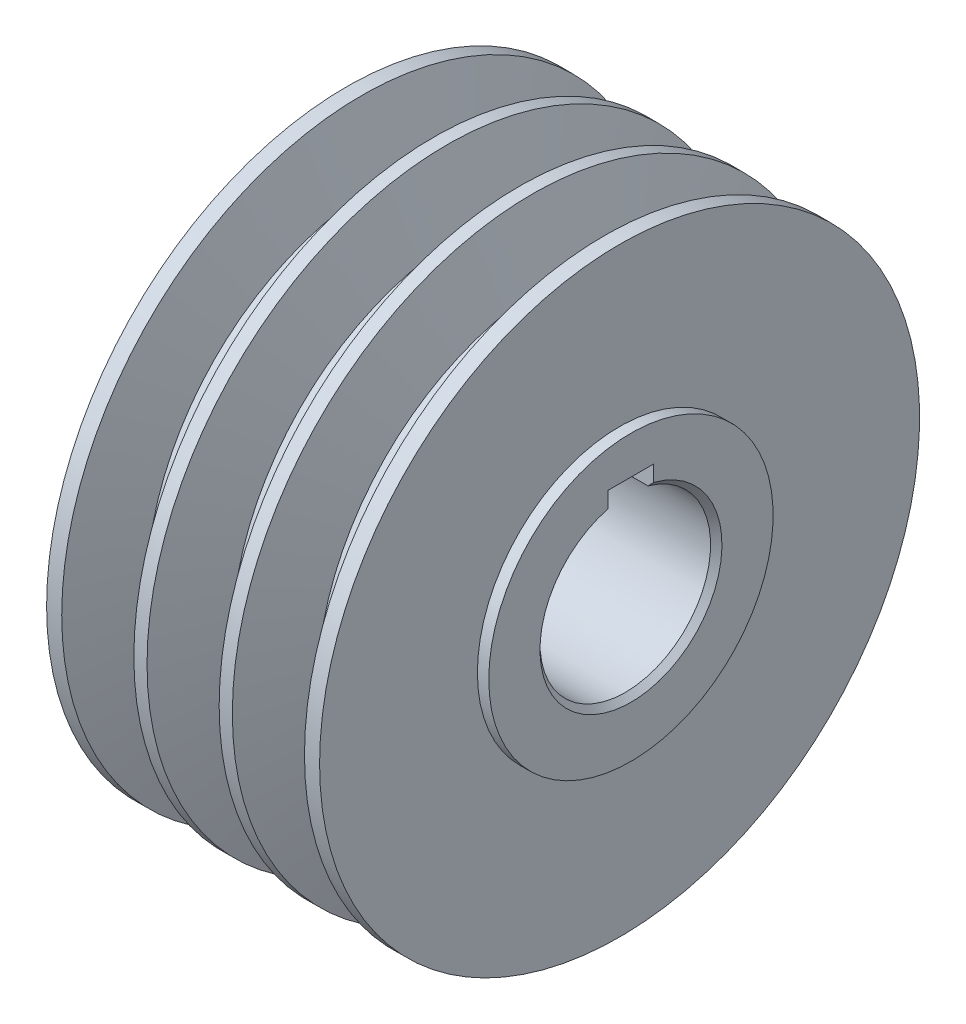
SolidWorks part; units mm, degrees
ref_plane "前视基准面" through (0, 0, 0) normal (0, 0, 1) x (1, 0, 0)
ref_plane "上视基准面" through (0, 0, 0) normal (0, 1, 0) x (1, 0, 0)
ref_plane "右视基准面" through (0, 0, 0) normal (1, 0, 0) x (0, 0, -1)
sketch "草图1" plane through (0, 0, 0) normal (0, 0, 1) x (1, 0, 0)
  line L0 (0, 0) -> (64.8368, 0) construction
  line L1 (0, 15) -> (0, 52.75)
  line L2 (0, 52.75) -> (48, 52.75)
  line L3 (48, 52.75) -> (48, 25)
  line L4 (48, 25) -> (50, 25)
  line L5 (50, 25) -> (50, 15)
  line L6 (50, 15) -> (0, 15)
  line L7 (2.6592, 52.75) -> (6.1599, 41.3) construction
  line L8 (6.1599, 41.3) -> (11.8401, 41.3) construction
  line L9 (11.8401, 41.3) -> (15.3408, 52.75) construction
  line L10 (0, 50) -> (48, 50) construction
  line L11 (9, 41.3) -> (9, 15) construction
  point P17 (3.5, 50)
  point P18 (14.5, 50)
  dimension "d2" = 105.5
  dimension "L" = 50
  dimension "B" = 48
  dimension "d" = 30
  dimension "d1" = 50
  dimension "dd" = 100
  dimension "f" = 9
  dimension "槽轮角" = 34
  dimension "bd" = 11
  dimension "hf" = 8.7
  dimension "ha" = 2.75
revolve "旋转1" add sketch "草图1" angle 360 about L0
sketch "草图2" plane through (0, 0, 0) normal (0, 0, 1) x (1, 0, 0)
  line L0 (11.8401, 41.3) -> (15.3408, 52.75) construction
  line L1 (6.1599, 41.3) -> (11.8401, 41.3) construction
  line L2 (2.6592, 52.75) -> (6.1599, 41.3) construction
  line L3 (11.8401, 41.3) -> (15.3408, 52.75)
  line L4 (6.1599, 41.3) -> (11.8401, 41.3)
  line L5 (2.6592, 52.75) -> (6.1599, 41.3)
  line L6 (2.6592, 52.75) -> (15.3408, 52.75)
  line L7 (0, 0) -> (48, 0) construction
  line L8 (48, -25) -> (48, 25) construction
revolve "切除-旋转1" cut sketch "草图2" angle 360 about L7
pattern_linear "阵列(线性)1" count 3 spacing 15 along (1, 0, 0) of "切除-旋转1"
chamfer "倒角1" distance 1 2 edges at (50, 0, 15) (0, 0, 15)
sketch "草图4" plane through (0, 0, 0) normal (-1, 0, 0) x (0, 0, 1)
  line L1 (-4, 14.4568) -> (4, 14.4568)
  line L2 (-4, 14.4568) -> (-4, 18.3)
  line L3 (-4, 18.3) -> (4, 18.3)
  line L4 (4, 14.4568) -> (4, 18.3)
  circle A0 centre (0, 0) radius 15 construction
  point P6 (0.7, 18.3)
  dimension "键槽高度" = 18.3
  dimension "键槽宽度" = 8
  dimension "t1" = 3.3
extrude "切除-拉伸1" cut sketch "草图4" against normal through all
equation "\"B@草图1\" =  ( \"z@阵列(线性)1\" - 1 )  * \"e@阵列(线性)1\" +2 *  \"f@草图1\""
equation "\"键槽高度@草图4\" = \"d@草图1\" / 2  + \"t1@草图4\""
